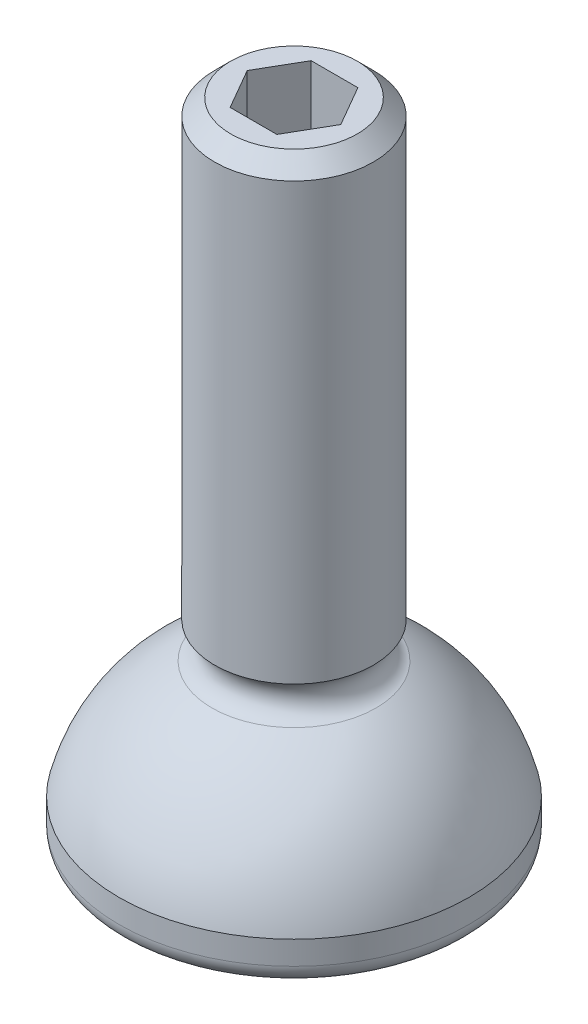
SolidWorks part; units mm, degrees
ref_plane "Front Plane" through (0, 0, 0) normal (0, 0, 1) x (1, 0, 0)
ref_plane "Top Plane" through (0, 0, 0) normal (0, 1, 0) x (1, 0, 0)
ref_plane "Right Plane" through (0, 0, 0) normal (1, 0, 0) x (0, 0, -1)
sketch "Sketch1" plane through (0, 0, 0) normal (0, 0, 1) x (1, 0, 0)
  line L0 (0, -1000) -> (0, 49000) construction
  line L1 (0, 0) -> (6.858, 0)
  line L2 (55, 0) -> (-55, 0) construction
  line L3 (6.858, 0) -> (6.858, 1.6818)
  line L5 (3.1115, 6.3387) -> (3.1115, 25.4)
  line L6 (3.1115, 25.4) -> (0, 25.4)
  line L7 (0, 25.4) -> (0, 0)
  arc A0 (6.858, 1.6818) -> (3.1115, 6.3387) centre (0, 0) ccw
  dimension "D4" = 7.0612
  dimension "D1" = 25.4
  dimension "D2" = 6.223
  dimension "D3" = 13.716
revolve "Revolve1" add sketch "Sketch1" angle 360 about L0
chamfer "Chamfer1" distance 0.635 angle 45 1 edges at (3.1115, 25.4, 0)
fillet "Fillet1" radius 0.762 1 edges at (6.858, 0, 0)
hole_wizard "Hole1" positions "3DSketch1" profile "Sketch7" legacy
sketch3d "3DSketch1"
  line L0 (0, 24.765, 0) -> (0, 25.4, 0) construction
  point P0 (17.7172, 0, -13.1596)
  point P2 (0, 25.4, 0)
sketch "Sketch7" plane through (0, 25.4, 0) normal (1, 0, 0) x (0, 0, 1)
  line L0 (0, 0) -> (0, 5.7799)
  line L1 (0, 5.7799) -> (1.5875, 4.826)
  line L2 (1.5875, 4.826) -> (1.5875, 0)
  line L4 (1.5875, 0) -> (0, 0)
  line L6 (0, 5.7799) -> (-1.5875, 4.826) construction
  line L7 (0, -4.2442) -> (0, 117.3081) construction
  dimension "Diameter" = 3.175
  dimension "Depth" = 4.826
  dimension "Drill Angle" = 118
sketch "Sketch4" plane through (0, 25.4, 0) normal (0, 1, 0) x (1, 0, 0)
  line L1 (0.9165, 1.5875) -> (-0.9165, 1.5875)
  line L2 (-0.9165, 1.5875) -> (-1.8331, 0)
  line L3 (-1.8331, 0) -> (-0.9165, -1.5875)
  line L4 (-0.9165, -1.5875) -> (0.9165, -1.5875)
  line L5 (0.9165, -1.5875) -> (1.8331, 0)
  line L6 (1.8331, 0) -> (0.9165, 1.5875)
  circle A0 centre (0, 0) radius 1.5875 construction
  dimension "D1" = 3.175
extrude "Cut-Extrude1" cut sketch "Sketch4" against normal blind 3.302
sketch "Sketch5" plane through (0, 0, 0) normal (0, 0, 1) x (1, 0, 0)
  line L0 (7.5438, 0) -> (-7.5438, 0) construction
  line L1 (0, -7.5438) -> (0, 7.5438) construction
  line L2 (0, -1000) -> (0, 49000) construction
  circle A0 centre (3.4544, 7.0104) radius 0.762
  dimension "D3" = 1.524
  dimension "D1" = 7.0104
  dimension "D2" = 3.4544
revolve "Cut-Revolve1" cut sketch "Sketch5" angle 360 about L2
